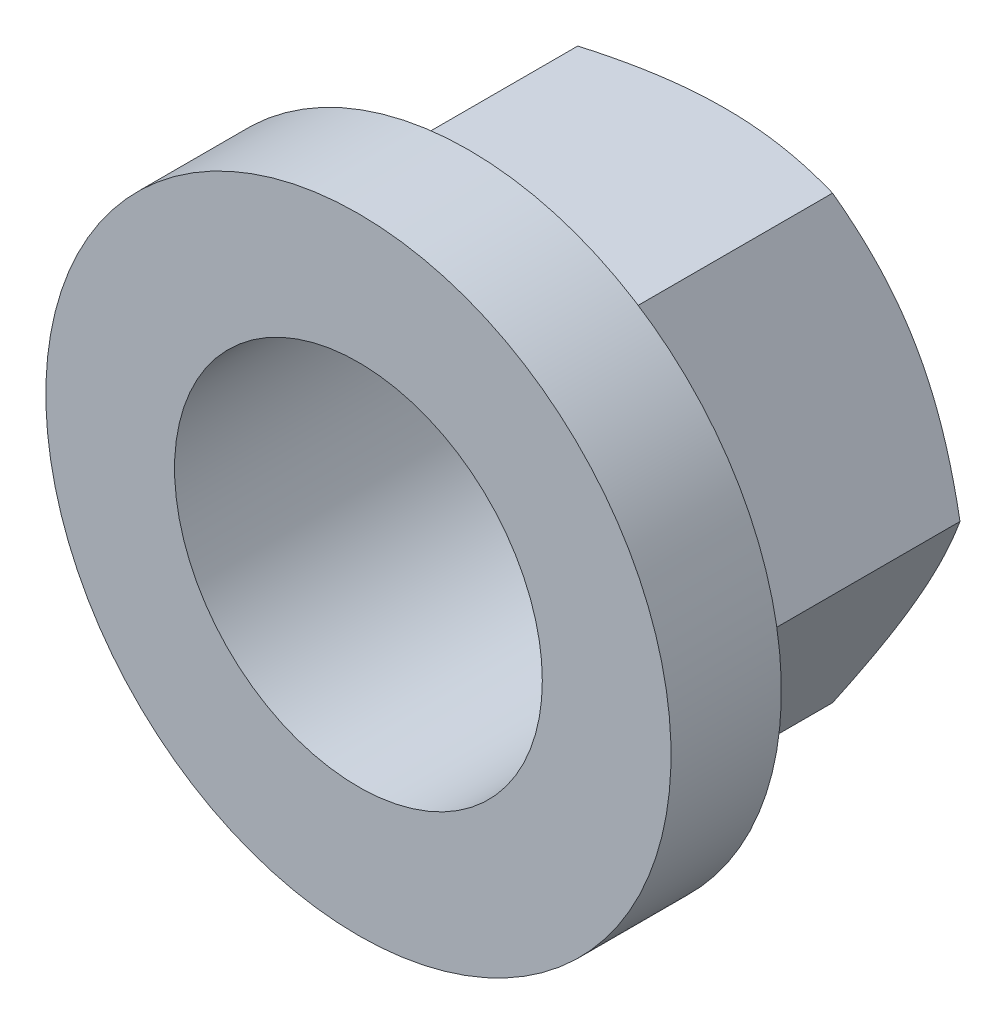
SolidWorks part; units mm, degrees
ref_plane "Plan1" through (0, 0, 0) normal (0, 0, 1) x (1, 0, 0)
ref_plane "Plan2" through (0, 0, 0) normal (0, 1, 0) x (1, 0, 0)
ref_plane "Plan3" through (0, 0, 0) normal (1, 0, 0) x (0, 0, -1)
sketch "Esquisse1" plane through (0, 0, 0) normal (0, 0, 1) x (1, 0, 0)
  line L3 (3.4641, -6) -> (6.9282, 0)
  line L4 (6.9282, 0) -> (3.4641, 6)
  line L5 (3.4641, 6) -> (-3.4641, 6)
  line L6 (-3.4641, 6) -> (-6.9282, 0)
  line L7 (-6.9282, 0) -> (-3.4641, -6)
  line L8 (-3.4641, -6) -> (3.4641, -6)
  circle A0 centre (0, 0) radius 6.9282 construction
  dimension "D3" = 12
extrude "Base-Extrusion" add sketch "Esquisse1" along normal mid plane 7.5
sketch "Esquisse5" plane through (0, 0, 0) normal (1, 0, 0) x (0, 0, -1)
  line L0 (3.75, -6) -> (-3.75, -18.9904)
  line L1 (0, 0) -> (-3.75, 0) construction
  line L2 (-3.75, -6) -> (-3.75, 0) construction
  line L3 (-3.75, -18.9904) -> (3.75, -18.9904)
  line L4 (3.75, -18.9904) -> (3.75, -6)
  line L5 (0, -12.4952) -> (3.75, -18.9904) construction
sketch "Esquisse4" plane through (0, 0, 3.75) normal (0, 0, 1) x (1, 0, 0)
  circle A0 centre (0, 0) radius 4
  dimension "D1" = 8
extrude "Enlèv. mat.-Extru.1" cut sketch "Esquisse4" against normal through all
revolve "Enlèvement de matière-Révolution1" cut sketch "Esquisse5" angle 360 about L1
mirror "Symétrie1" about plane through (0, 0, 0) normal (0, 0, 1) of "Enlèvement de matière-Révolution1"
sketch "Esquisse6" plane through (0, 0, 0) normal (1, 0, 0) x (0, 0, -1)
  line L0 (0, 0) -> (-31.0154, 0) construction
  line L1 (-3.2141, 0) -> (-6.2141, 0)
  line L2 (-3.2141, 0) -> (-3.2141, 8.5)
  line L3 (-3.2141, 8.5) -> (-6.2141, 8.5)
  line L4 (-6.2141, 0) -> (-6.2141, 8.5)
  dimension "D1" = 3
  dimension "D2" = 17
revolve "Révolution1" add sketch "Esquisse6" angle 360 about L0
sketch "Esquisse7" plane through (0, 0, 3.2141) normal (0, 0, -1) x (-1, 0, 0)
  circle A1 centre (0, 0) radius 4
  circle A2 centre (0, 0) radius 4
  dimension "D1" = 0
extrude "Enlèv. mat.-Extru.2" cut sketch "Esquisse7" against normal through all
sketch "Esquisse8" plane through (0, 0, 6.2141) normal (0, 0, 1) x (1, 0, 0)
  circle A0 centre (0, 0) radius 5
  dimension "D1" = 10
extrude "Enlèv. mat.-Extru.3" cut sketch "Esquisse8" against normal through all
equation "\"D1@Esquisse4\" = 0.8*\"D2@Représentation de filetage1\""
